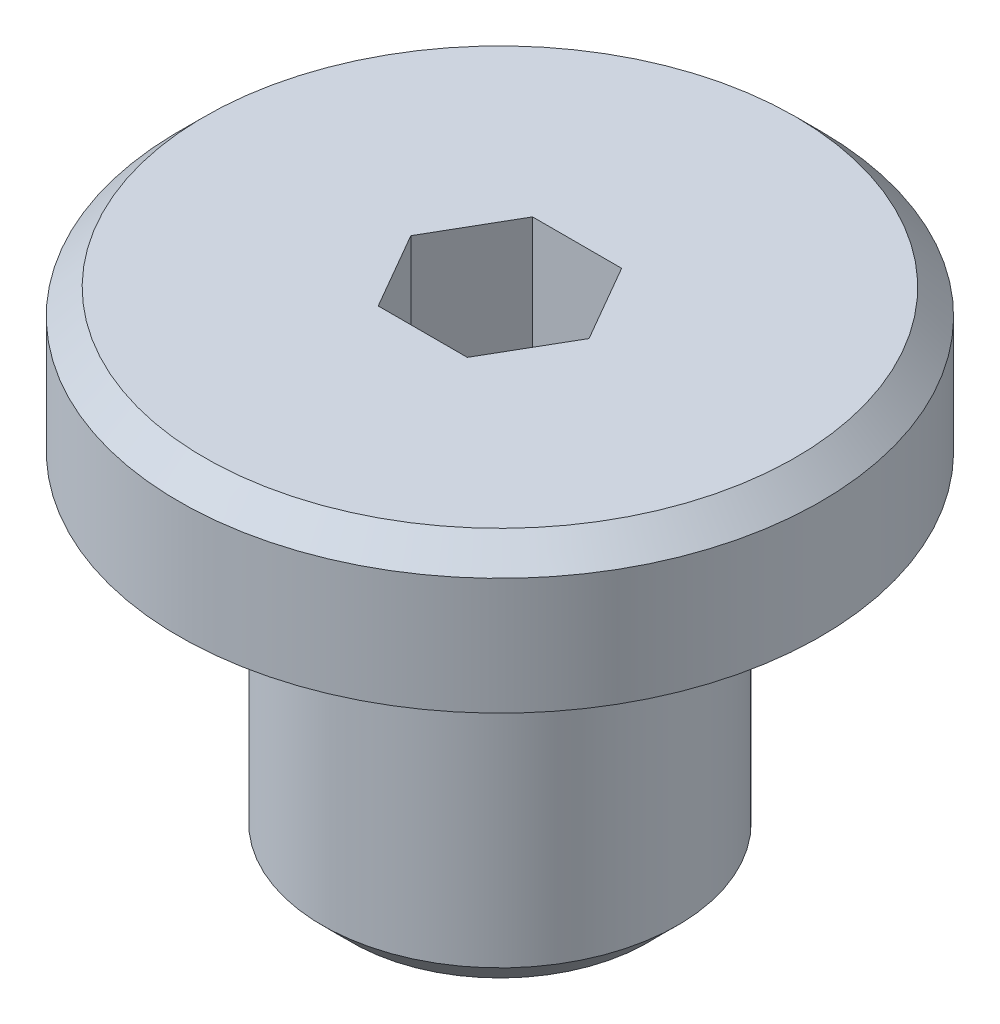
SolidWorks part; units mm, degrees
ref_plane "Front Plane" through (0, 0, 0) normal (0, 0, 1) x (1, 0, 0)
ref_plane "Top Plane" through (0, 0, 0) normal (0, 1, 0) x (1, 0, 0)
ref_plane "Right Plane" through (0, 0, 0) normal (1, 0, 0) x (0, 0, -1)
sketch "Sketch1" plane through (0, 0, 0) normal (1, 0, 0) x (0, 0, -1)
  line L0 (5.1308, 0) -> (10.033, 0)
  line L1 (10.033, 0) -> (10.033, 3.6512)
  line L2 (9.2392, 4.445) -> (0, 4.445)
  line L3 (0, 4.445) -> (0, -10.9982)
  line L4 (0, -10.9982) -> (4.6228, -10.9982)
  line L5 (5.5562, -10.0648) -> (5.5562, -2.8384)
  line L6 (0, 0) -> (0, 28.8242) construction
  line L7 (4.6228, -10.9982) -> (5.5562, -10.0648)
  line L8 (4.6228, -0.508) -> (4.6228, -1.905)
  line L9 (4.6228, -1.905) -> (5.5562, -2.8384)
  line L10 (9.2392, 4.445) -> (10.033, 3.6512)
  arc A1 (5.1308, 0) -> (4.6228, -0.508) centre (5.1308, -0.508) ccw
  dimension "D5" = 45
  dimension "D7" = 4.445
  dimension "D8" = 0.508
  dimension "D1" = 20.066
  dimension "D2" = 45
  dimension "D3" = 15.4432
  dimension "D4" = 11.1125
  dimension "D6" = 0.7937
  dimension "D9" = 9.2456
  dimension "D10" = 45
  dimension "D11" = 1.905
revolve "Revolve1" add sketch "Sketch1" angle 360 about L6
sketch "Sketch6" plane through (0, 4.445, 0) normal (0, 1, 0) x (1, 0, 0)
  line L1 (-1.3931, 2.413) -> (-2.7863, 0)
  line L2 (-2.7863, 0) -> (-1.3931, -2.413)
  line L3 (-1.3931, -2.413) -> (1.3931, -2.413)
  line L4 (1.3931, -2.413) -> (2.7863, 0)
  line L5 (2.7863, 0) -> (1.3931, 2.413)
  line L6 (1.3931, 2.413) -> (-1.3931, 2.413)
  circle A0 centre (0, 0) radius 2.413 construction
  dimension "D1" = 4.826
extrude "Cut-Extrude1" cut sketch "Sketch6" against normal blind 4.445
ref_plane "Plane1" through (0, 0, 0) normal (-1, 0, 0) x (0, 0, -1)
ref_plane "Plane2" through (0, 0, 0) normal (-1, 0, 0) x (0, 0, -1)
ref_plane "Plane3" through (0, 0, 0) normal (-1, 0, 0) x (0, 0, -1)
ref_plane "Plane4" through (0, 0, 0) normal (-1, 0, 0) x (0, 0, -1)
ref_plane "Plane5" through (0, 0, 0) normal (-1, 0, 0) x (0, 0, -1)
ref_plane "Plane6" through (0, 0, 0) normal (-1, 0, 0) x (0, 0, -1)
sketch "Sketch9" plane through (0, 0, 0) normal (-1, 0, 0) x (0, 0, -1)
  line L0 (6.9977, -1.0889) -> (6.9024, 0)
  line L1 (6.9024, 0) -> (9.7346, 0)
  line L2 (9.7346, 0) -> (9.6393, -1.0889)
  line L3 (9.3863, -1.3208) -> (7.2507, -1.3208)
  line L4 (0, 50) -> (0, -50) construction
  arc A0 (9.6393, -1.0889) -> (9.3863, -1.3208) centre (9.3863, -1.0668) cw
  arc A1 (7.2507, -1.3208) -> (6.9977, -1.0889) centre (7.2507, -1.0668) cw
revolve "Groove for AS 568-015, O-Ring1" cut sketch "Sketch9"
